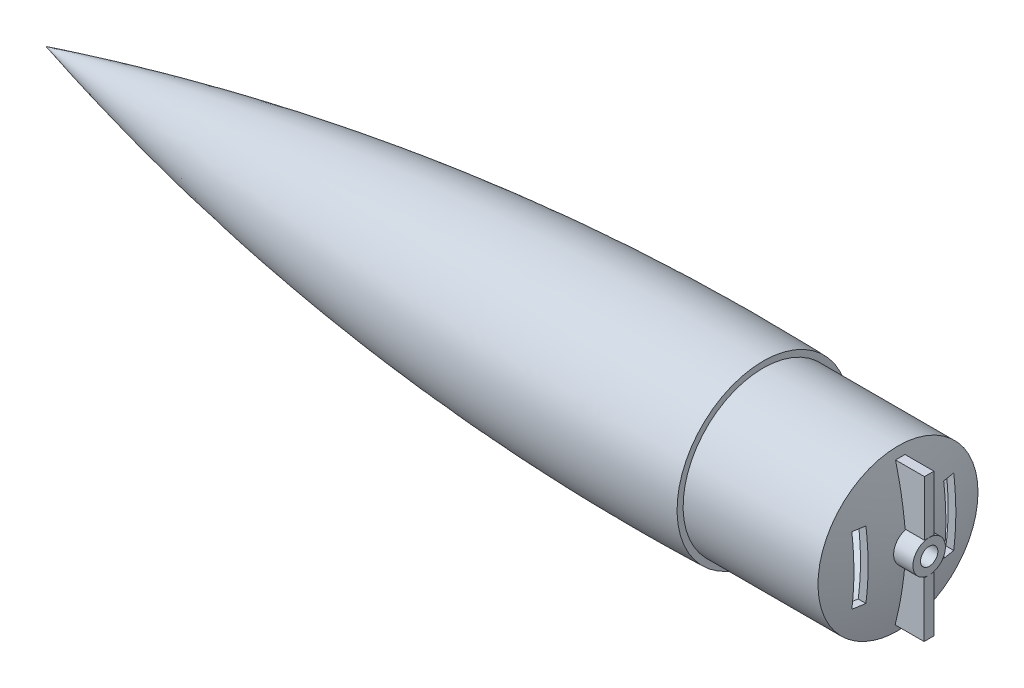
SolidWorks part; units mm, degrees
ref_plane "Front Plane" through (0, 0, 0) normal (0, 0, 1) x (1, 0, 0)
ref_plane "Top Plane" through (0, 0, 0) normal (0, 1, 0) x (1, 0, 0)
ref_plane "Right Plane" through (0, 0, 0) normal (1, 0, 0) x (0, 0, -1)
sketch "Sketch1" plane through (0, 0, 0) normal (0, 0, 1) x (1, 0, 0)
  line L0 (0, 0) -> (0, -2.032)
  line L1 (0, -2.032) -> (49.784, -2.032)
  line L2 (49.784, -2.032) -> (49.784, -28.956)
  line L3 (49.784, -28.956) -> (-241.3, -28.956) construction
  line L4 (49.784, -28.956) -> (-241.3, -28.956)
  arc A0 (0, 0) -> (-241.3, -28.956) centre (-22.0451, -836.1859) ccw
  dimension "D1" = 2.032
  dimension "D2" = 49.784
  dimension "D3" = 28.956
revolve "Revolve1" add sketch "Sketch1" angle 360 about L3
sketch "Sketch17" plane through (0, 0, 0) normal (0, 0, 1) x (1, 0, 0)
  line L0 (-241.3, -28.956) -> (49.784, -28.956) construction
  line L1 (49.784, -55.88) -> (49.784, -2.032) construction
  line L2 (47.3044, -55.7072) -> (82.6125, -66.6944)
  line L3 (82.6125, -66.6944) -> (82.6125, -28.956)
  line L4 (82.6125, -28.956) -> (49.784, -28.956)
  arc A0 (49.784, -28.956) -> (47.3044, -55.7072) centre (-95.758, -28.956) cw
sketch "Sketch22" plane through (0, 0, 0) normal (0, 0, 1) x (1, 0, 0)
  line L0 (49.784, -28.956) -> (67.5791, -28.956)
  line L1 (49.784, -2.032) -> (0, -2.032) construction
  line L2 (45.3869, -2.032) -> (67.5791, 4.171)
  line L3 (67.5791, -28.956) -> (67.5791, 4.171)
  arc A0 (49.784, -28.956) -> (45.3869, -2.032) centre (-73.5622, -35.2795) ccw
revolve "Cut-Revolve7" cut sketch "Sketch22" angle 360 about L0
sketch "Sketch26" plane through (0, 0, 0) normal (1, 0, 0) x (0, 0, -1)
  circle A1 centre (0, -28.956) radius 5.461
  dimension "D1" = 10.922
extrude "Extrude2" add sketch "Sketch26" along normal blind 55.88
shell "Shell2" thickness 2.54
sketch "Sketch27" plane through (0, 0, 0) normal (1, 0, 0) x (0, 0, -1)
  line L0 (0, -28.956) -> (-38.6172, -28.956) construction
  line L1 (-17.145, -17.653) -> (-13.081, -17.653)
  line L2 (-17.145, -17.653) -> (-17.145, -40.259)
  line L3 (-17.145, -40.259) -> (-13.081, -40.259)
  line L4 (-13.081, -17.653) -> (-13.081, -40.259)
  line L5 (0, -28.956) -> (25.5064, -28.956) construction
  line L7 (13.081, -17.653) -> (17.145, -17.653)
  line L8 (13.081, -17.653) -> (13.081, -40.259)
  line L9 (13.081, -40.259) -> (17.145, -40.259)
  line L10 (17.145, -17.653) -> (17.145, -40.259)
  dimension "D2" = 4.064
  dimension "D3" = 22.606
  dimension "D4" = 4.064
  dimension "D5" = 22.606
  dimension "D6" = 13.081
sketch "Sketch28" plane through (55.88, 0, 0) normal (1, 0, 0) x (0, 0, -1)
  line L1 (-1.7145, -52.9513) -> (1.5875, -52.9513)
  line L2 (-1.5875, -23.4836) -> (1.5875, -23.4836)
  line L3 (-1.5875, -23.4836) -> (-1.5875, -4.9416)
  line L4 (-1.5875, -4.9416) -> (1.5875, -4.9416)
  line L5 (1.5875, -23.4836) -> (1.5875, -4.9416)
  line L6 (-1.7145, -52.9513) -> (-1.7145, -34.4093)
  line L7 (-1.7145, -34.4093) -> (1.5875, -34.4093)
  line L8 (1.5875, -52.9513) -> (1.5875, -34.4093)
  dimension "D2" = 3.175
  dimension "D1" = 18.542
  dimension "D3" = 18.542
  dimension "D4" = 3.302
extrude "Extrude3" add sketch "Sketch28" against normal blind 10.16
extrude "Cut-Extrude3" cut sketch "Sketch27" along normal through all
